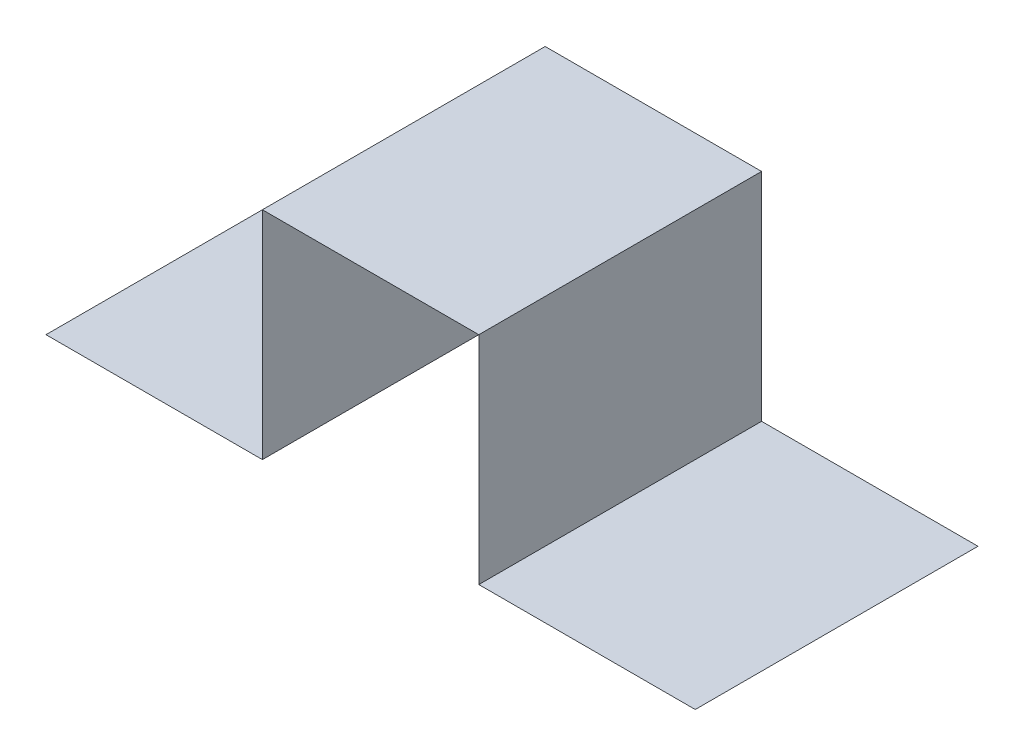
SolidWorks part; units mm, degrees
ref_plane "Front" through (0, 0, 0) normal (0, 0, 1) x (1, 0, 0)
ref_plane "Top" through (0, 0, 0) normal (0, 1, 0) x (1, 0, 0)
ref_plane "Right" through (0, 0, 0) normal (1, 0, 0) x (0, 0, -1)
sketch "Sketch1" plane through (0, 0, 0) normal (0, 0, 1) x (1, 0, 0)
  line L0 (0, 0) -> (41.3303, 0)
  line L1 (41.3303, 0) -> (41.3303, 41.3303)
  line L2 (41.3303, 41.3303) -> (82.6605, 41.3303)
  line L3 (82.6605, 41.3303) -> (82.6605, 0)
  line L4 (82.6605, 0) -> (123.9908, 0)
surface "Surface-Extrude1" sketch "Sketch1" parameters "D1"=54
